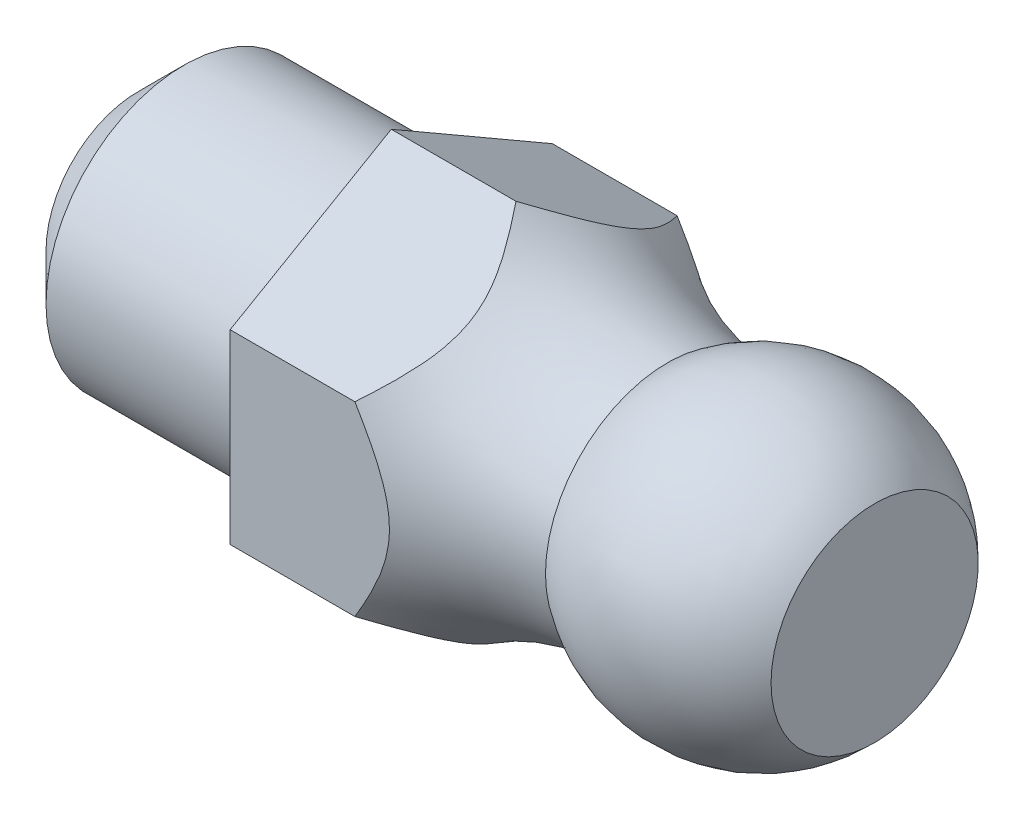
SolidWorks part; units mm, degrees
ref_plane "Plane1" through (0, 0, 0) normal (0, 0, 1) x (1, 0, 0)
ref_plane "Plane2" through (0, 0, 0) normal (0, 1, 0) x (1, 0, 0)
ref_plane "Plane3" through (0, 0, 0) normal (1, 0, 0) x (0, 0, -1)
sketch "Grundkörper" plane through (0, 0, 0) normal (0, 0, 1) x (1, 0, 0)
  line L0 (0, 0) -> (0, 3)
  line L1 (0, 3) -> (5.5, 3)
  line L2 (5.5, 3) -> (5.5, 4.05)
  line L3 (5.5, 4.05) -> (8.2, 4.05)
  line L4 (16, 2.25) -> (16, 0)
  line L5 (16, 0) -> (0, 0)
  line L6 (-3.3756, 0) -> (24.0118, 0) construction
  arc A0 (8.2, 4.05) -> (11.5, 2.65) centre (12.0863, 8.6213) ccw
  arc A1 (11.5, 2.65) -> (16, 2.25) centre (13.5251, -0.0799) cw
  dimension "D4" = 3.399
  dimension "D8" = 5.3
  dimension "D9" = 6
  dimension "D1" = 8.1
  dimension "D2" = 5.5
  dimension "D3" = 6
  dimension "D5" = 16
  dimension "D6" = 8.2
  dimension "D7" = 11.5
  dimension "D10" = 4.5
revolve "Basis-Rotation" add sketch "Grundkörper"
chamfer "Gewindefase" distance 1 angle 45 1 edges at (0, 0, 3)
sketch "Schlüsselfläche-SW9" plane through (5.5, 0, 0) normal (-1, 0, 0) x (0, 0, 1)
  line L0 (0, 0) -> (8.8439, 0) construction
  line L1 (0, 0) -> (0, 6.7819) construction
  line L2 (0, 4.0415) -> (3.5, 2.0207)
  line L3 (3.5, 2.0207) -> (3.5, -2.0207)
  line L4 (0, -4.0415) -> (3.5, -2.0207)
  line L5 (0, -4.0415) -> (-3.5, -2.0207)
  line L6 (-3.5, 2.0207) -> (-3.5, -2.0207)
  line L7 (0, 4.0415) -> (-3.5, 2.0207)
  point P10 (3.5, 0)
  dimension "D2" = 7
  dimension "D3" = 7
extrude "Schnitt-Linear austragen1" cut sketch "Schlüsselfläche-SW9" against normal through all contours L7 L2 L3 L4 L5 L6 M8
